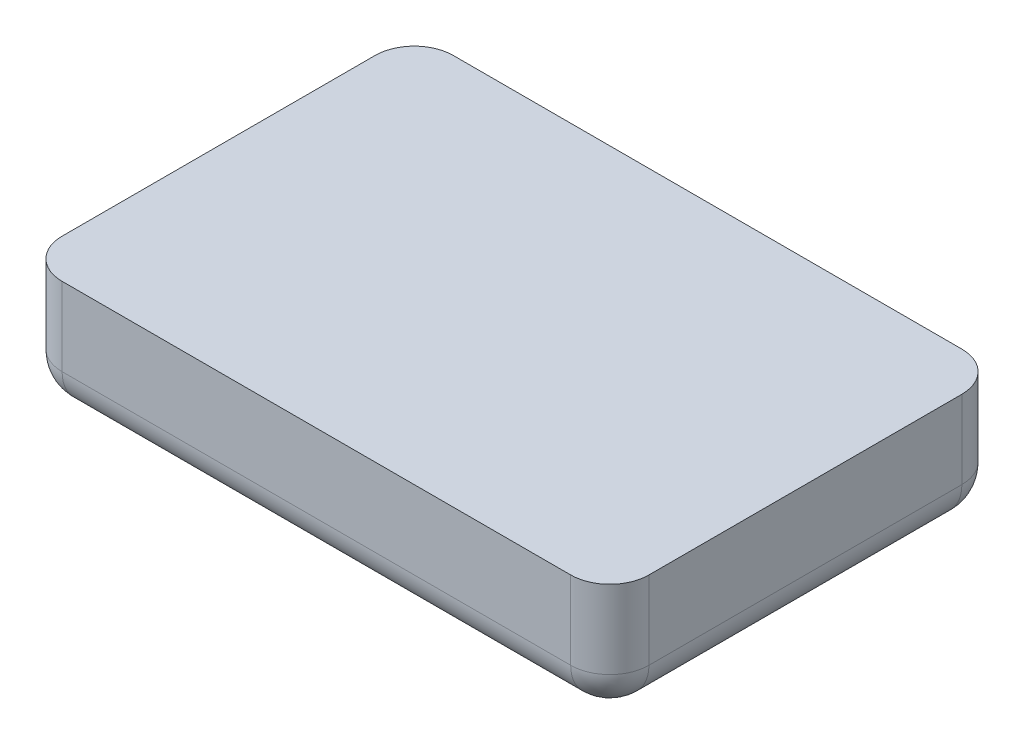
SolidWorks part; units mm, degrees
ref_plane "Front" through (0, 0, 0) normal (0, 0, 1) x (1, 0, 0)
ref_plane "Top" through (0, 0, 0) normal (0, 1, 0) x (1, 0, 0)
ref_plane "Right" through (0, 0, 0) normal (1, 0, 0) x (0, 0, -1)
sketch "Sketch2" plane through (0, 0, 0) normal (0, 1, 0) x (1, 0, 0)
  line L0 (75, -50) -> (-75, 50) construction
  line L1 (-75, 50) -> (75, 50)
  line L2 (-75, 50) -> (-75, -50)
  line L3 (-75, -50) -> (75, -50)
  line L4 (75, 50) -> (75, -50)
  dimension "D1" = 150
  dimension "D2" = 100
extrude "Extrude1" add sketch "Sketch2" along normal blind 30
fillet "Fillet1" radius 10 8 edges at (0, 0, 50) (75, 0, 0) (0, 0, -50) (-75, 0, 0) (-75, 15, -50) (-75, 15, 50) (75, 15, -50) (75, 15, 50)
